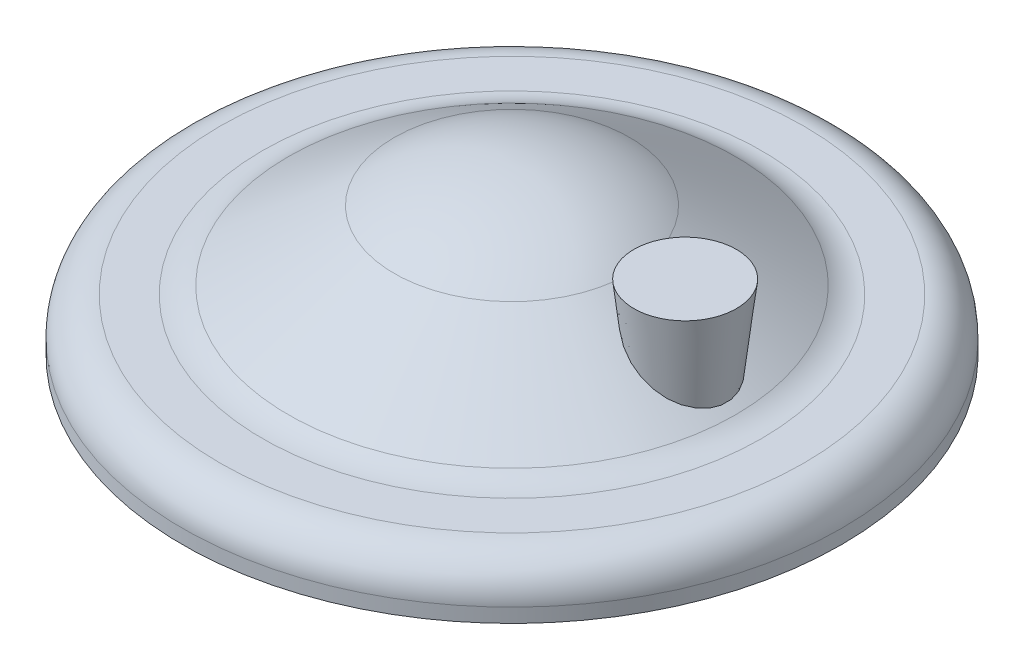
SolidWorks part; units mm, degrees
ref_plane "Front Plane" through (0, 0, 0) normal (0, 0, 1) x (1, 0, 0)
ref_plane "Top Plane" through (0, 0, 0) normal (0, 1, 0) x (1, 0, 0)
ref_plane "Right Plane" through (0, 0, 0) normal (1, 0, 0) x (0, 0, -1)
sketch "Sketch1" plane through (0, 0, 0) normal (0, 0, -1) x (1, 0, 0)
  line L0 (78.74, 0) -> (67.2963, 0)
  line L1 (60.3265, -2.0834) -> (31.782, -20.8229)
  line L2 (0, -30.3232) -> (-27.2886, -30.3232) construction
  line L3 (0, -30.3232) -> (0, 0) construction
  line L4 (88.9, 10.16) -> (88.9, 13.97)
  arc A0 (67.2963, 0) -> (60.3265, -2.0834) centre (67.2963, -12.7) ccw
  arc A1 (31.782, -20.8229) -> (0, -30.3232) centre (0, 27.5882) cw
  arc A2 (78.74, 0) -> (88.9, 10.16) centre (78.74, 10.16) ccw
  point P11 (63.5, 0)
  point P15 (88.9, 0)
  dimension "D1" = 12.7
  dimension "D8" = 10.16
  dimension "D3" = 177.8
  dimension "D5" = 127
revolve "Revolve-Thin1" add sketch "Sketch1"
other "body1" parameters "D1"=360, "D3"=6.35, "D4"=1, "D7"=0
sketch "Sketch2" plane through (0, 0, 0) normal (0, 0, 1) x (1, 0, 0)
  line L0 (46.708, 26.9997) -> (46.708, 40.281) construction
  line L1 (32.8694, 26.9997) -> (46.708, 26.9997)
  line L2 (32.8694, 26.9997) -> (36.189, -1.6694)
  line L3 (36.189, -1.6694) -> (46.708, -1.6694)
  line L4 (46.708, -1.6694) -> (46.708, 26.9997)
  line L5 (46.708, -1.6694) -> (46.708, 26.9997) construction
  line L6 (-88.9, -13.97) -> (88.9, -13.97) construction
  line L7 (0, 30.3232) -> (0, 0) construction
  dimension "D1" = 27.6772
  dimension "D2" = 21.0381
  dimension "D3" = 12.3006
  dimension "D4" = 46.708
  dimension "D5" = 28.6691
revolve "Revolve1" add sketch "Sketch2"
other "body2" parameters "D1"=360
fillet "Fillet1" radius 0.7937 1 edges at (46.708, -1.6694, -10.519)
